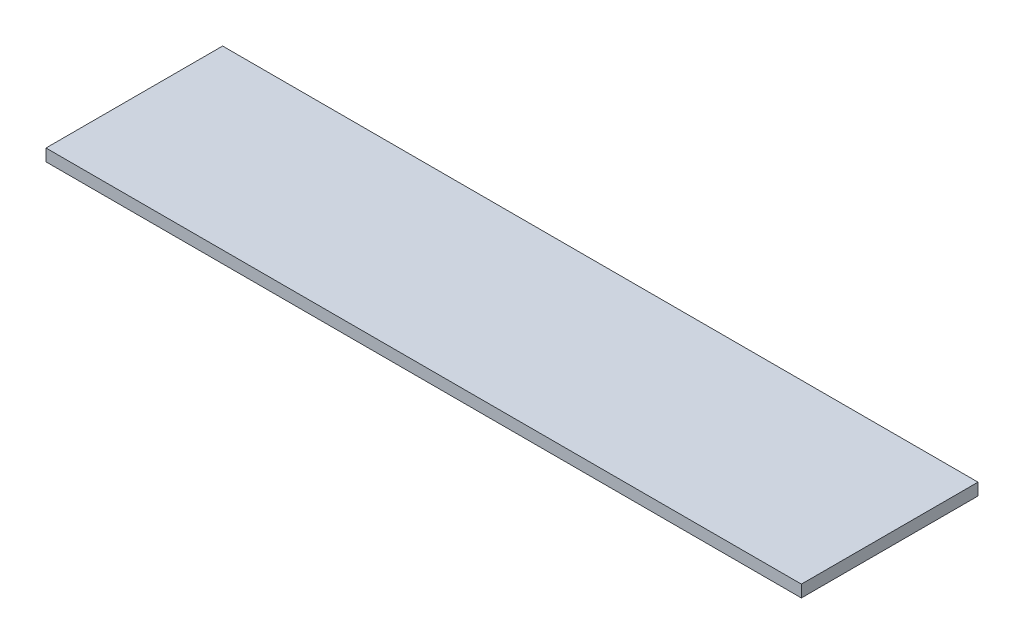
SolidWorks part; units mm, degrees
ref_plane "Front Plane" through (0, 0, 0) normal (1, 0, 0) x (0, 1, 0)
ref_plane "Top Plane" through (0, 0, 0) normal (0, 0, 1) x (0, 1, 0)
ref_plane "Right Plane" through (0, 0, 0) normal (0, 1, 0) x (-1, 0, 0)
sketch "sk w193" plane through (0, 0, 0) normal (0, 0, 1) x (0, 1, 0)
  point P0 (-399.034, -196.596)
  point P3 (-188.214, 0)
  line B0 (-399.034, -196.596) -> (-399.034, -160.02)
  line B1 (-399.034, -160.02) -> (-226.06, -160.02)
  line B2 (-210.82, -144.78) -> (-210.82, 144.78)
  line B3 (-226.06, 160.02) -> (-399.034, 160.02)
  line B4 (-399.034, 160.02) -> (-399.034, 196.596)
  line B5 (-399.034, 196.596) -> (0, 196.596)
  line B6 (0, 196.596) -> (0, 160.02)
  line B7 (0, 160.02) -> (-172.974, 160.02)
  line B8 (-188.214, 144.78) -> (-188.214, -144.78)
  line B9 (-172.974, -160.02) -> (0, -160.02)
  line B10 (0, -160.02) -> (0, -196.596)
  line B11 (0, -196.596) -> (-399.034, -196.596)
  arc B12 (-226.06, -160.02) -> (-210.82, -144.78) centre (-226.06, -144.78) ccw
  arc B13 (-210.82, 144.78) -> (-226.06, 160.02) centre (-226.06, 144.78) ccw
  arc B14 (-172.974, 160.02) -> (-188.214, 144.78) centre (-172.974, 144.78) ccw
  arc B15 (-188.214, -144.78) -> (-172.974, -160.02) centre (-172.974, -144.78) ccw
sketch_block_instance "w14x193-1-1"
sketch_block "w14x193-1" parameters "D4"=15.24, "D1"=399.034, "D2"=393.192, "D3"=22.606, "D5"=36.576
sketch "Sketch2" plane through (0, 0, 0) normal (0, 0, 1) x (0, 1, 0)
  line L0 (320, 501.4782) -> (320, -809.7231)
  line L1 (-188.214, 144.78) -> (-188.214, -144.78)
  line L2 (-188.214, -144.78) -> (-172.974, -160.02)
  line L3 (-172.974, -160.02) -> (5, -160.02)
  line L4 (-188.214, 144.78) -> (-172.974, 160.02)
  line L5 (-172.974, 160.02) -> (5, 160.02)
  line L6 (5, 201.596) -> (5, 160.02)
  line L7 (0, 196.596) -> (0, 160.02) construction
  line L8 (5, -160.02) -> (5, -201.596)
  line L9 (-285.82, 201.596) -> (5, 201.596)
  line L10 (-285.82, -201.596) -> (5, -201.596)
  line L11 (-285.82, 201.596) -> (-285.82, 239.696)
  line L12 (-285.82, 239.696) -> (167.6, 501.4782)
  line L13 (-285.82, -201.596) -> (-285.82, -239.696)
  line L14 (-285.82, -239.696) -> (167.6, -809.7231)
  line L15 (-210.82, -144.78) -> (-210.82, 144.78) construction
  line L16 (-399.034, 196.596) -> (0, 196.596) construction
  line L17 (0, -196.596) -> (-399.034, -196.596) construction
  line L18 (320, 501.4782) -> (167.6, 501.4782)
  line L19 (320, -809.7231) -> (167.6, -809.7231)
  point P30 (320, 501.4782)
  point P31 (320, -809.7231)
  dimension "D1" = 320
  dimension "D2" = 5
  dimension "D3" = 75
  dimension "D4" = 5
  dimension "D5" = 5
  dimension "D6" = 30
  dimension "D7" = 51.5
  dimension "D8" = 38.1
  dimension "D9" = 38.1
  dimension "D10" = 152.4
sketch "Sketch3" plane through (0, 0, 0) normal (0, 1, 0) x (-1, 0, 0)
  line L6 (-598.782, 140) -> (598.782, 140)
  line L7 (-598.782, 140) -> (-598.782, -140)
  line L8 (-598.782, -140) -> (598.782, -140)
  line L9 (598.782, 140) -> (598.782, -140)
  point P4 (0, 140)
  point P5 (598.782, 0)
  dimension "D1" = 280
  dimension "D2" = 1197.564
extrude "Boss-Extrude1" add sketch "Sketch3" along normal blind 19.05
chamfer "Chamfer1" [suppressed] distance 15 angle 30
